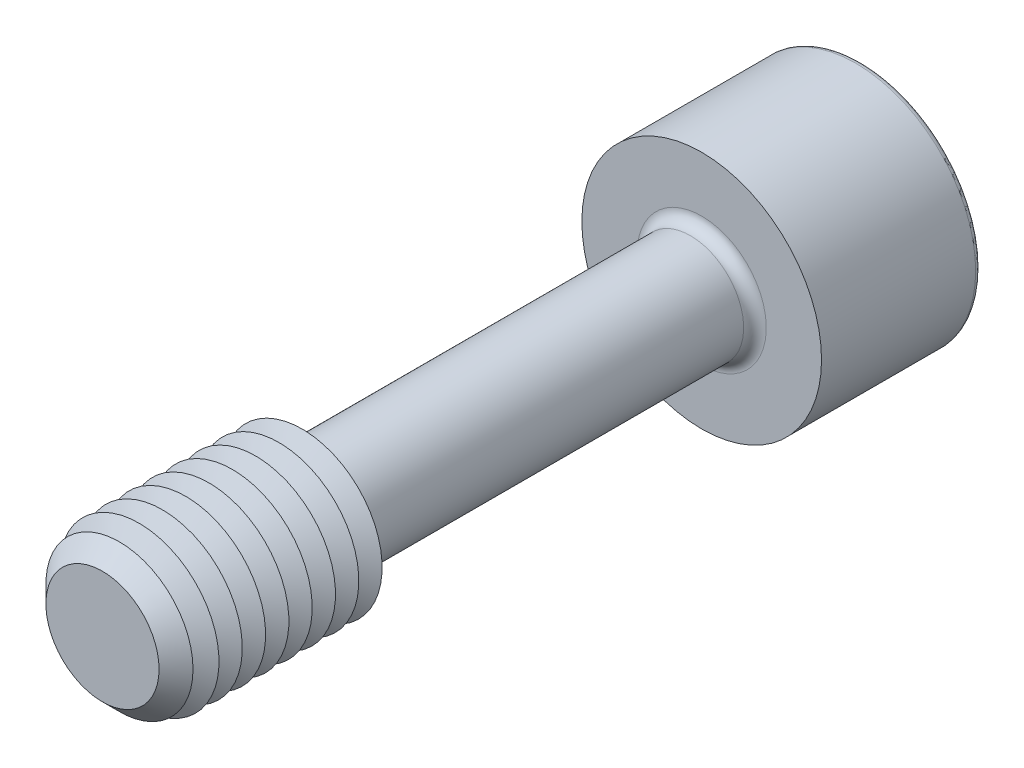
SolidWorks part; units mm, degrees
ref_plane "Front Plane" through (0, 0, 0) normal (0, 0, 1) x (1, 0, 0)
ref_plane "Top Plane" through (0, 0, 0) normal (0, 1, 0) x (1, 0, 0)
ref_plane "Right Plane" through (0, 0, 0) normal (1, 0, 0) x (0, 0, -1)
sketch "Sketch1" plane through (0, 0, 0) normal (0, 0, 1) x (1, 0, 0)
  circle A0 centre (0, 0) radius 4
  dimension "D1" = 8
extrude "Extrude1" add sketch "Sketch1" along normal mid plane 45
sketch "Sketch2" plane through (0, 0, 0) normal (1, 0, 0) x (0, 0, -1)
  line L0 (-22.5, 0) -> (-22.5, 6)
  line L1 (-22.5, 4) -> (-22.5, -4) construction
  line L2 (-22.5, 6) -> (-7.5, 6)
  line L3 (-7.5, 6) -> (-6.3453, 4)
  line L4 (22.5, 4) -> (-22.5, 4) construction
  line L5 (-6.3453, 4) -> (-6.3453, 0)
  line L6 (-6.3453, 0) -> (-22.5, 0)
  dimension "D1" = 6
  dimension "D2" = 120
  dimension "D3" = 15
revolve "Revolve1" add sketch "Sketch2" angle 360 about L6
chamfer "Chamfer1" distance 1.75 angle 45 1 edges at (0, 6, 22.5)
sketch "Sketch3" plane through (0, 0, -22.5) normal (0, 0, -1) x (-1, 0, 0)
  circle A0 centre (0, 0) radius 9
  dimension "D1" = 18
extrude "Extrude2" add sketch "Sketch3" along normal blind 12
sketch "Sketch4" plane through (-13.7, 0, -34.5) normal (0, 0, 1) x (1, 0, 0)
  line L2 (10.8132, -5) -> (16.5868, -5)
  line L3 (16.5868, -5) -> (19.4735, 0)
  line L4 (19.4735, 0) -> (16.5868, 5)
  line L6 (16.5868, 5) -> (10.8132, 5)
  line L7 (10.8132, 5) -> (7.9265, 0)
  line L8 (7.9265, 0) -> (10.8132, -5)
  circle A0 centre (13.7, 0) radius 5 construction
  dimension "D1" = 10
extrude "Extrude3" cut sketch "Sketch4" along normal blind 10
fillet "Fillet1" radius 0.85 1 edges at (-4, 0, -22.5)
fillet "Fillet2" radius 0.425 1 edges at (-9, 0, -34.5)
sketch "Sketch5" plane through (0, 0, 0) normal (1, 0, 0) x (0, 0, -1)
  line L0 (24.5, 0) -> (24.5, -5)
  line L1 (24.5, -5) -> (21.6132, 0)
  line L2 (21.6132, 0) -> (24.5, 0)
  dimension "D1" = 30
revolve "Cut-Revolve1" cut sketch "Sketch5" angle 360 about L2
sketch "Sketch6" plane through (0, 0, 0) normal (1, 0, 0) x (0, 0, -1)
  line L0 (1.332, 0) -> (-13.289, 0) construction
sketch "Sketch7" plane through (0, 0, 0) normal (1, 0, 0) x (0, 0, -1)
  line L0 (-7.5, 6) -> (-8.375, 4.4845)
  line L1 (-8.375, 4.4845) -> (-9.25, 6)
  line L2 (-7.5, 6) -> (-20.75, 6) construction
  line L3 (-9.25, 6) -> (-7.5, 6)
  dimension "D1" = 1.75
revolve "Cut-Revolve2" cut sketch "Sketch7" angle 360 about L0
pattern_linear "LPattern1" count 8 spacing 1.75 along (0, 0, 1) of "Cut-Revolve2"
